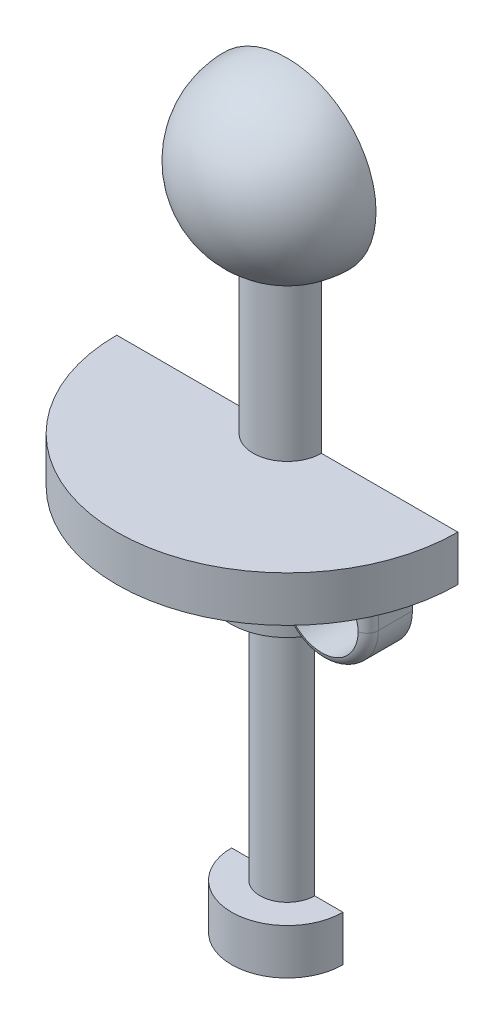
SolidWorks part; units mm, degrees
ref_plane "Front Plane" through (0, 0, 0) normal (0, 0, 1) x (1, 0, 0)
ref_plane "Top Plane" through (0, 0, 0) normal (0, 1, 0) x (1, 0, 0)
ref_plane "Right Plane" through (0, 0, 0) normal (1, 0, 0) x (0, 0, -1)
body saved out of another part "Stock-roll_damper_piston_rod3-1"
